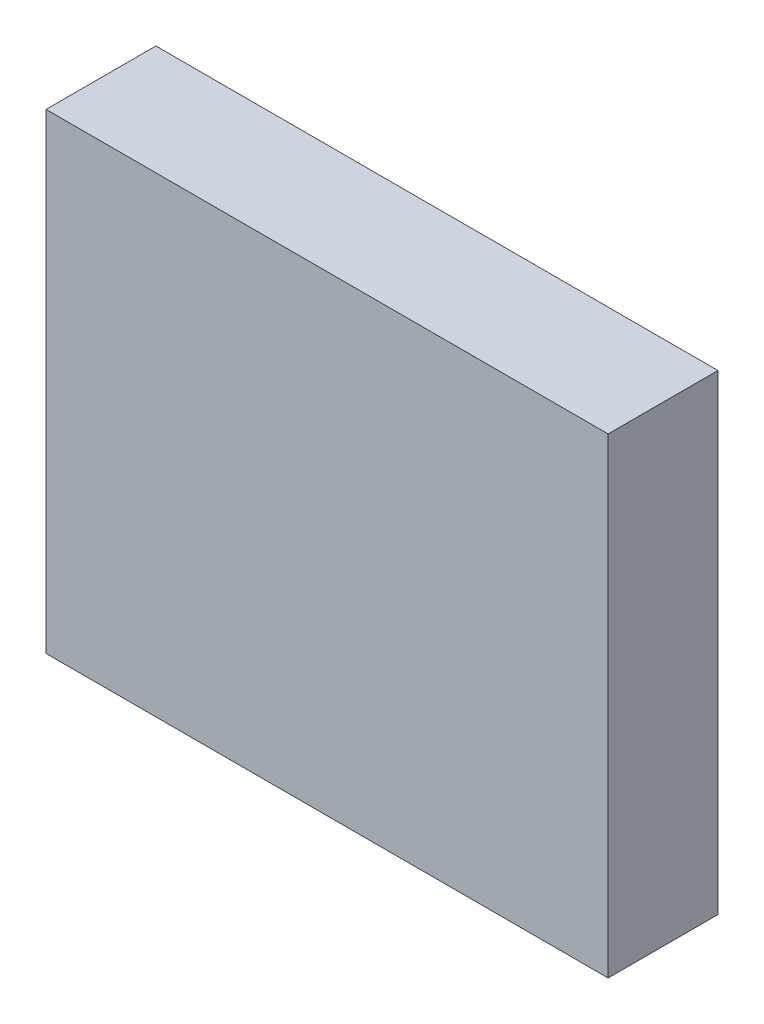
SolidWorks part; units mm, degrees
ref_plane "Ebene vorne" through (0, 0, 0) normal (0, 0, 1) x (1, 0, 0)
ref_plane "Ebene oben" through (0, 0, 0) normal (0, 1, 0) x (1, 0, 0)
ref_plane "Ebene rechts" through (0, 0, 0) normal (1, 0, 0) x (0, 0, -1)
sketch "Skizze1" plane through (0, 0, 0) normal (0, 0, 1) x (1, 0, 0)
  line L1 (295.3478, -230.733) -> (397.699, -230.733)
  line L2 (295.3478, -230.733) -> (295.3478, -316.5323)
  line L3 (295.3478, -316.5323) -> (397.699, -316.5323)
  line L4 (397.699, -230.733) -> (397.699, -316.5323)
extrude "Linear austragen1" add sketch "Skizze1" along normal blind 20
